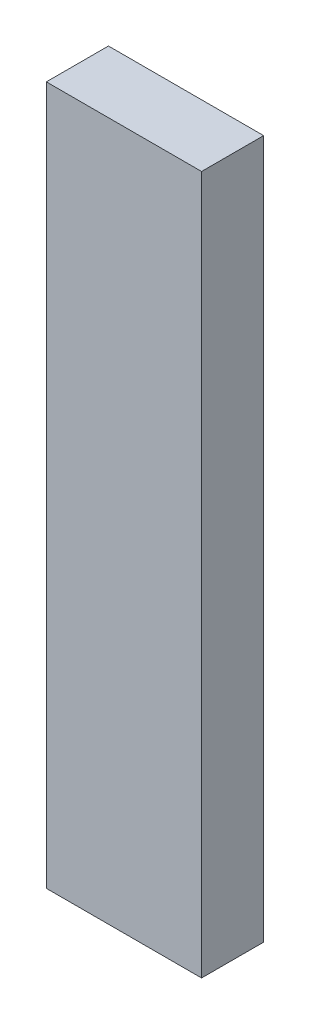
SolidWorks part; units mm, degrees
ref_plane "Plan de face" through (0, 0, 0) normal (0, 0, 1) x (1, 0, 0)
ref_plane "Plan de dessus" through (0, 0, 0) normal (0, 1, 0) x (1, 0, 0)
ref_plane "Plan de droite" through (0, 0, 0) normal (1, 0, 0) x (0, 0, -1)
sketch "Esquisse1" plane through (0, 0, 0) normal (0, 0, 1) x (1, 0, 0)
  line L1 (0, 0) -> (20, 0)
  line L2 (0, 0) -> (0, 90)
  line L3 (0, 90) -> (20, 90)
  line L4 (20, 0) -> (20, 90)
  dimension "D1" = 20
  dimension "D2" = 90
extrude "Extrusion1" add sketch "Esquisse1" along normal blind 8
